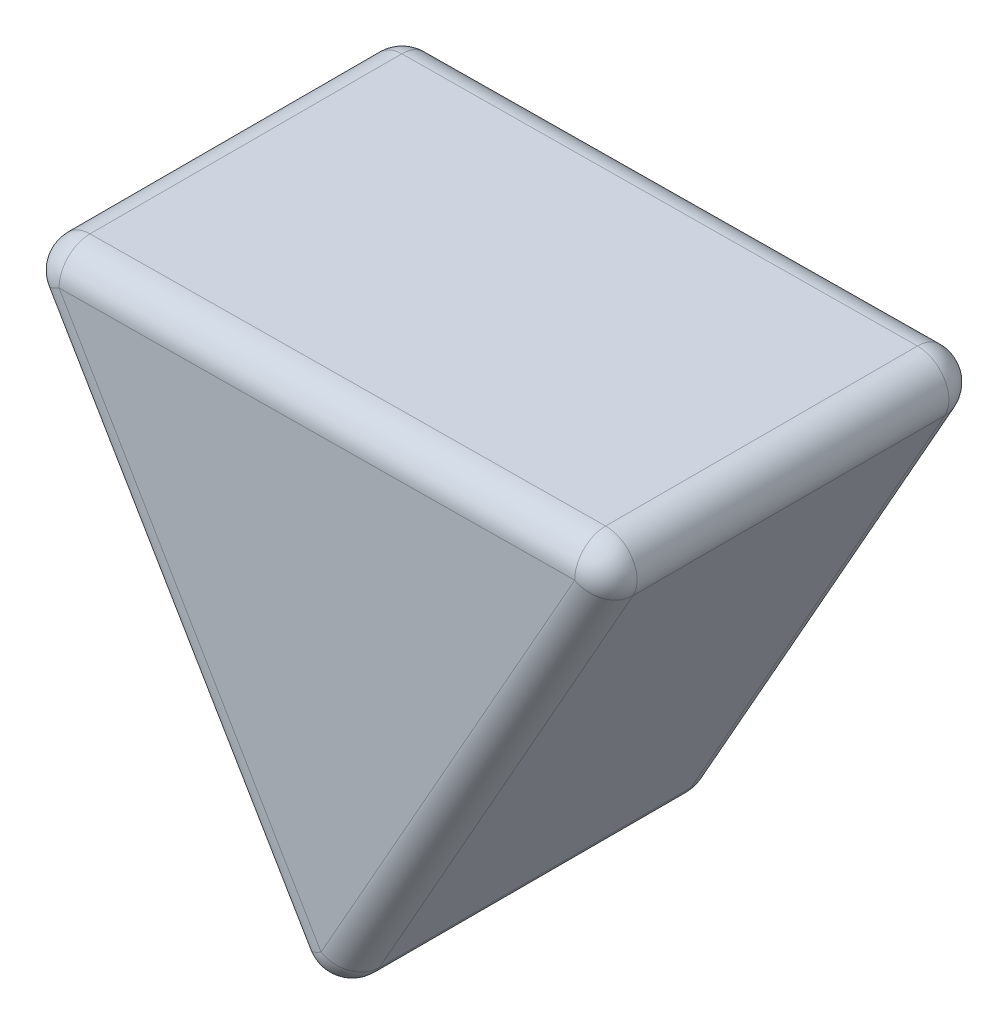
SolidWorks part; units mm, degrees
ref_plane "Front" through (0, 0, 0) normal (0, 0, 1) x (1, 0, 0)
ref_plane "Top" through (0, 0, 0) normal (0, 1, 0) x (1, 0, 0)
ref_plane "Right" through (0, 0, 0) normal (1, 0, 0) x (0, 0, -1)
sketch "Esquisse1" plane through (0, 0, 0) normal (0, 0, 1) x (1, 0, 0)
  line L1 (-30.0534, 5.866) -> (-50.0534, 5.681)
  line L2 (-50.0534, 5.681) -> (-39.8932, -11.547)
  line L3 (-39.8932, -11.547) -> (-30.0534, 5.866)
  circle A0 centre (-40, 0) radius 5.7737 construction
  dimension "D1" = 20
extrude "Boss.-Extru.1" add sketch "Esquisse1" along normal blind 12 contours L1 L2 L3
fillet "Congé1" radius 1 9 edges at (-40.0534, 5.7735, 0) (-44.9733, -2.933, 0) (-34.9733, -2.8405, 0) (-44.9733, -2.933, 12) (-40.0534, 5.7735, 12) (-34.9733, -2.8405, 12) (-39.8932, -11.547, 6) (-30.0534, 5.866, 6) (-50.0534, 5.681, 6)
